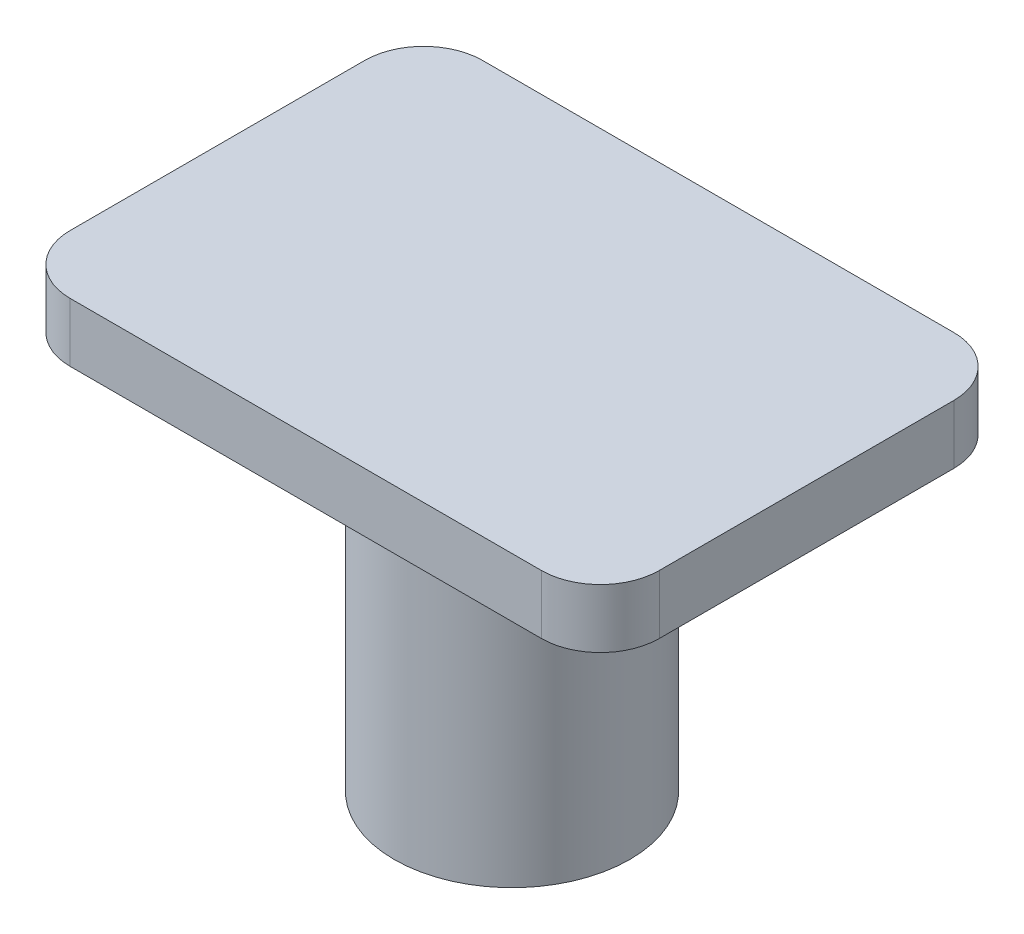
SolidWorks part; units mm, degrees
ref_plane "Front Plane" through (0, 0, 0) normal (0, 0, 1) x (1, 0, 0)
ref_plane "Top Plane" through (0, 0, 0) normal (0, 1, 0) x (1, 0, 0)
ref_plane "Right Plane" through (0, 0, 0) normal (1, 0, 0) x (0, 0, -1)
sketch "Sketch1" plane through (0, 0, 0) normal (0, 1, 0) x (1, 0, 0)
  circle A0 centre (0, 0) radius 10
  dimension "D1" = 20
extrude "Extrude-Thin1" add sketch "Sketch1" along normal blind 30 thin
sketch "Sketch2" plane through (0, 30, 0) normal (0, 1, 0) x (-1, 0, 0)
  line L0 (0, -17.5) -> (0, 17.5) construction
  line L1 (25, -17.5) -> (-25, -17.5)
  line L2 (25, -17.5) -> (25, 17.5)
  line L3 (25, 17.5) -> (-25, 17.5)
  line L4 (-25, -17.5) -> (-25, 17.5)
  dimension "D1" = 50
  dimension "D2" = 35
extrude "Extrude1" add sketch "Sketch2" along normal blind 5
fillet "Fillet1" radius 5 4 edges at (25, 32.5, -17.5) (25, 32.5, 17.5) (-25, 32.5, -17.5) (-25, 32.5, 17.5)
